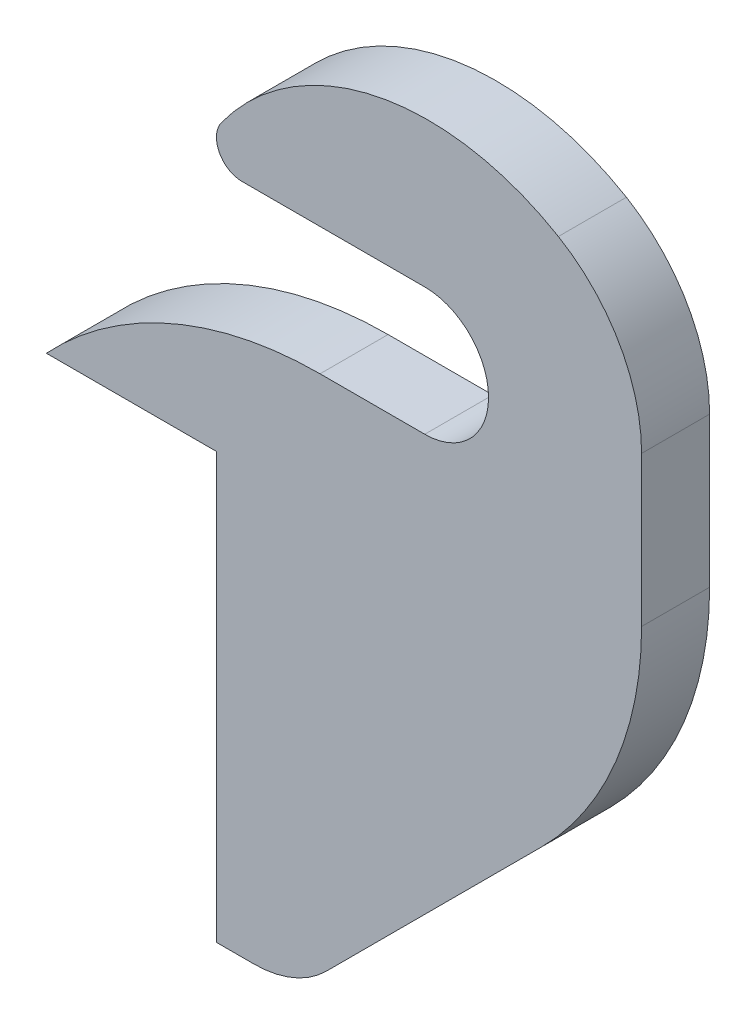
SolidWorks part; units mm, degrees
ref_plane "Plan de face" through (0, 0, 0) normal (0, 0, 1) x (1, 0, 0)
ref_plane "Plan de dessus" through (0, 0, 0) normal (0, 1, 0) x (1, 0, 0)
ref_plane "Plan de droite" through (0, 0, 0) normal (1, 0, 0) x (0, 0, -1)
sketch "Esquisse1" plane through (0, 0, 0) normal (0, 0, 1) x (1, 0, 0)
  line L0 (0, 0) -> (-10, 0)
  line L1 (0, 0) -> (0, -25)
  line L2 (0, -25) -> (2.2132, -25)
  line L3 (6.4558, -23.2426) -> (19.1421, -10.5563)
  line L4 (25, 3.5858) -> (25, 12.3992)
  line L5 (1.5, 14.5) -> (12.25, 14.5)
  line L6 (12.25, 7) -> (6.0935, 7)
  arc A0 (2.2132, -25) -> (6.4558, -23.2426) centre (2.2132, -19) ccw
  arc A1 (19.1421, -10.5563) -> (25, 3.5858) centre (5, 3.5858) ccw
  arc A2 (20.1057, 20.9975) -> (0.2837, 16.8778) centre (12.4471, 8.1) ccw
  arc A3 (0.2837, 16.8778) -> (1.5, 14.5) centre (1.5, 16) ccw
  arc A4 (12.25, 14.5) -> (12.25, 7) centre (12.25, 10.75) cw
  arc A5 (6.0935, 7) -> (-10, 0) centre (6.0935, -15) ccw
  arc A6 (25, 12.3992) -> (20.1057, 20.9975) centre (15, 12.3992) ccw
  dimension "D1" = 15
  dimension "D5" = 1.5
  dimension "D6" = 10
  dimension "D8" = 9
  dimension "D10" = 6
  dimension "D12" = 20
  dimension "D14" = 22
  dimension "D15" = 8.6
  dimension "D2" = 10
  dimension "D3" = 25
  dimension "D4" = 7.5
  dimension "D7" = 25
  dimension "D9" = 25
  dimension "D11" = 45
  dimension "D13" = 32
  dimension "D16" = 21
extrude "Boss.-Extru.1" add sketch "Esquisse1" along normal blind 4
